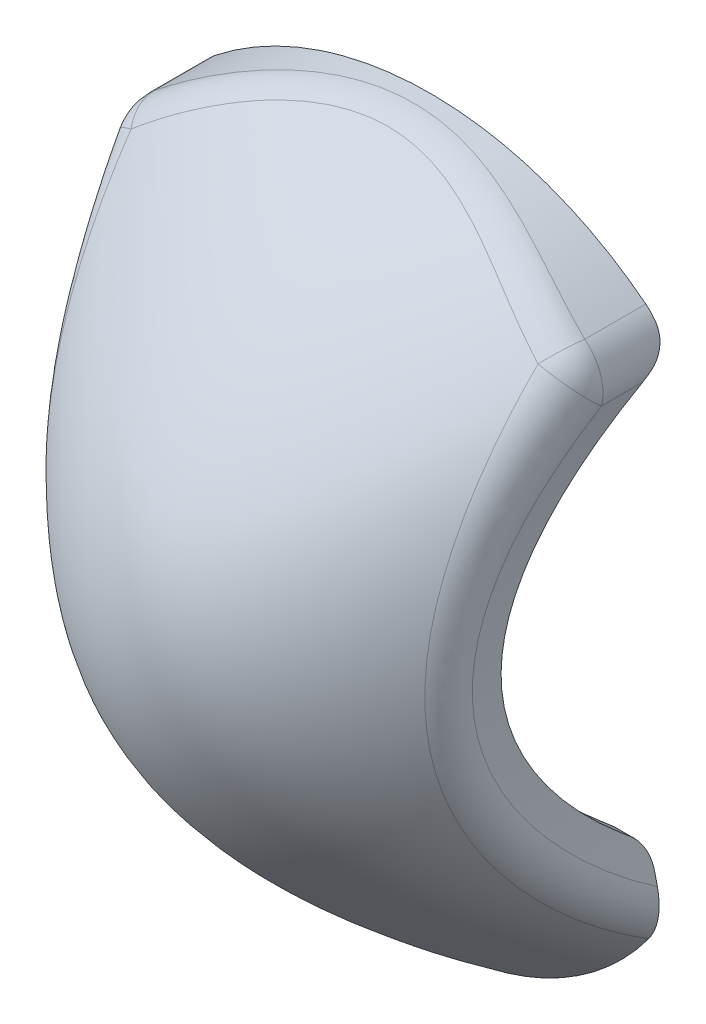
SolidWorks part; units mm, degrees
ref_plane "Płaszczyzna przednia" through (0, 0, 0) normal (0, 0, 1) x (1, 0, 0)
ref_plane "Płaszczyzna górna" through (0, 0, 0) normal (0, 1, 0) x (1, 0, 0)
ref_plane "Płaszczyzna prawa" through (0, 0, 0) normal (1, 0, 0) x (0, 0, -1)
body saved out of another part "Zapas-Mysz-baza-1"
